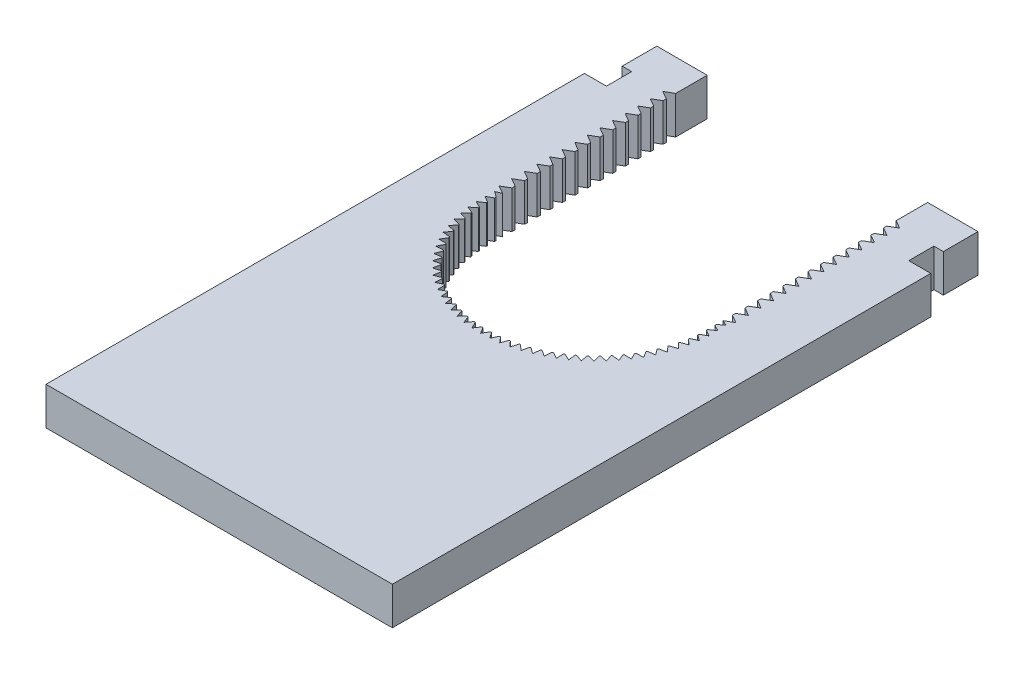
SolidWorks part; units mm, degrees
ref_plane "Front Plane" through (0, 0, 0) normal (0, 0, 1) x (1, 0, 0)
ref_plane "Top Plane" through (0, 0, 0) normal (0, 1, 0) x (1, 0, 0)
ref_plane "Right Plane" through (0, 0, 0) normal (1, 0, 0) x (0, 0, -1)
sketch "Sketch1" plane through (0, 0, 0) normal (0, 1, 0) x (1, 0, 0)
  line L1 (-27.5, -60) -> (27.5, -60)
  line L3 (0, 0) -> (0, 35) construction
  line L5 (-17.5, 0) -> (-17.5, 35)
  line L6 (-17.5, 0) -> (-17.5, 35) construction
  line L8 (-25.5, 35) -> (-17.5, 35)
  line L10 (-25.5, 25.4165) -> (-25.5, 25.5)
  line L11 (25.5, 35) -> (17.5, 35)
  line L12 (25.5, 25.4165) -> (25.5, 25.5)
  line L13 (-25.5, 29.5) -> (-25.5, 35)
  line L14 (-25.5, 29.5) -> (-24, 29.5)
  line L16 (-25.5, 25.5) -> (-24, 25.5)
  line L17 (-24, 29.5) -> (-24, 25.5)
  line L18 (25.5, 25.5) -> (24, 25.5)
  line L19 (24, 29.5) -> (24, 25.5)
  line L20 (25.5, 29.5) -> (24, 29.5)
  line L21 (25.5, 29.5) -> (25.5, 35)
  line L22 (0, 25.5) -> (0, 50025.5) construction
  line L23 (-27.5, -60) -> (27.5, -60)
  line L24 (-27.5, -60) -> (-27.5, 25.5)
  line L25 (-27.5, 25.5) -> (-24, 25.5)
  line L26 (27.5, -60) -> (27.5, 25.5)
  line L27 (0, 0) -> (-50000, 0) construction
  line L28 (24, 25.5) -> (27.5, 25.5)
  line L29 (17.5, 0) -> (17.5, 35)
  arc A0 (-17.5, 0) -> (17.5, 0) centre (0, 0) ccw
  point P4 (-17.5, 0)
  point P5 (27.5, 24.6616)
  point P7 (27.5, 13.5)
  point P16 (-9.8117, 35.7831)
  point P32 (0, -60)
  point P33 (-27.5, -22.2947)
  point P35 (0, 0)
  point P40 (27.5, -13.5)
  point P42 (0, 0)
  point P43 (-27.5, -13.5)
  point P44 (-27.5, -7.7769)
  point P45 (-27.5, 25.4165)
  point P50 (-27.5, 13.5)
  dimension "D1" = 35
  dimension "D2" = 60
  dimension "D6" = 35
  dimension "D7" = 8
  dimension "D8" = 55
  dimension "D9" = 4
  dimension "D10" = 1.5
  dimension "D11" = 1.5
  dimension "D12" = 5.5
  dimension "D14" = 12
extrude "Boss-Extrude1" add sketch "Sketch1" along normal mid plane 6
sketch "Sketch2" plane through (0, 3, 0) normal (0, 1, 0) x (1, 0, 0)
  line L3 (0, 0) -> (0, -17.3952) construction
  line L4 (-0.772, -17.2139) -> (0.728, -17.1885)
  line L5 (-0.772, -17.2139) -> (0, -18.5)
  line L6 (0, -18.5) -> (0.728, -17.1885)
  line L7 (0, -17.3952) -> (0, -18.5) construction
  point P2 (-0.6272, -17.3355)
  point P3 (0, -18.548)
  point P6 (-0.0154, -17.4935)
  point P10 (-0.022, -17.2012)
  point P12 (-0.0154, -17.3952)
  point P13 (0, 0)
  point P14 (0.8014, -17.4816)
  point P15 (-0.7101, -17.4361)
  point P16 (0.7599, -17.4777)
  point P17 (0.7286, -17.4848)
  point P18 (0.728, -17.4975)
  dimension "D1" = 1.5
  dimension "D2" = 1.5
  dimension "D3" = 1.5
  dimension "D4" = 17.3952
  dimension "D5" = 18.5
extrude "Cut-Extrude1" cut sketch "Sketch2" against normal blind 6
pattern_circular "CirPattern2" count 82 over 360 about axis through (0, 0, 0) along (0, 1, 0) of "Cut-Extrude1"
sketch "Sketch6" plane through (0, 3, 0) normal (0, 1, 0) x (1, 0, 0)
  line L0 (-18.7867, 29.25) -> (-16.2133, 29.25) construction
  line L1 (-17.5, 28.5) -> (-17.5, 30)
  line L2 (-17.5, 4.9968) -> (-17.5, 35) construction
  line L3 (-17.5, 30) -> (-18.799, 29.25)
  line L4 (-18.799, 29.25) -> (-17.5, 28.5)
  point P7 (-17.5, 29.25)
  dimension "D1" = 1.5
  dimension "D2" = 1.5
  dimension "D3" = 5
extrude "Cut-Extrude2" cut sketch "Sketch6" against normal blind 10
pattern_linear "LPattern1" count 14 spacing 2 along (0, 0, 1) of "Cut-Extrude2"
mirror "Mirror1" about plane through (0, 0, 0) normal (1, 0, 0) of "Cut-Extrude2", "LPattern1"
pattern_circular "CirPattern1" count 63 over 360
fillet "Fillet1" radius 3
sketch "Sketch5" plane through (0, 3, 0) normal (0, 1, 0) x (1, 0, 0)
  line L0 (0, -23) -> (50000, -23) construction
  dimension "D1" = 23
